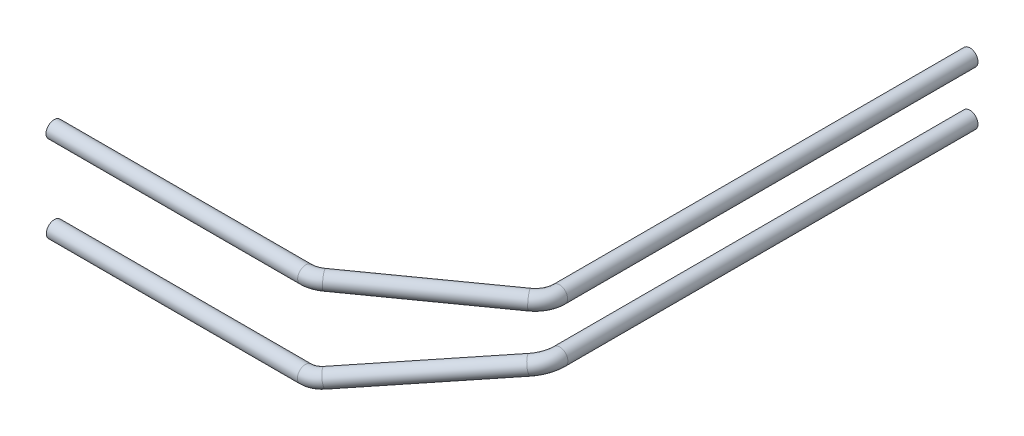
SolidWorks part; units mm, degrees
ref_plane "Front Plane" through (0, 0, 0) normal (0, 0, 1) x (1, 0, 0)
ref_plane "Top Plane" through (0, 0, 0) normal (0, 1, 0) x (1, 0, 0)
ref_plane "Right Plane" through (0, 0, 0) normal (1, 0, 0) x (0, 0, -1)
ref_plane "Drivers Side" through (635, 0, 0) normal (1, 0, 0) x (0, 0, -1)
ref_plane "Passengers Side" through (-635, 0, 0) normal (1, 0, 0) x (0, 0, -1)
ref_plane "Front" through (0, 0, 635) normal (0, 0, 1) x (1, 0, 0)
ref_plane "Top" through (0, 127, 0) normal (0, 1, 0) x (1, 0, 0)
sketch3d "3DSketch1"
  line L0 (635, 0, 376.4876) -> (635, 0, -588.4348)
  line L1 (-635, 0, 635) -> (-635, 0, -635) construction
  line L2 (-635, 0, 635) -> (635, 0, 635) construction
  line L3 (635, 0, 635) -> (635, 0, -635) construction
  line L4 (-635, 0, -635) -> (635, 0, -635) construction
  line L5 (-635, 0, 635) -> (635, 0, -635) construction
  line L6 (635, 0, 635) -> (-635, 0, -635) construction
  line L7 (-295.2601, -76.2, 635) -> (295.2601, -76.2, 635)
  line L8 (329.593, -72.5753, 624.126) -> (611.087, -5.6826, 423.4477)
  line L9 (0, 0, 0) -> (0, -76.2, 635) construction
  line L10 (-296.0068, 127, 635) -> (296.0542, 127, 635)
  line L11 (329.2293, 127, 624.3853) -> (611.0252, 127, 423.4918)
  line L12 (635, 127, 376.9565) -> (635, 127, -588.4348)
  arc A0 (635, 0, 376.4876) -> (611.087, -5.6826, 423.4477) centre (579.3984, -13.2129, 376.4876) ccw
  arc A1 (295.2601, -76.2, 635) -> (329.593, -72.5753, 624.126) centre (295.2601, -58.1276, 580.7827) ccw
  arc A2 (611.0252, 127, 423.4918) -> (635, 127, 376.9565) centre (577.85, 127, 376.9565) ccw
  arc A3 (296.0542, 127, 635) -> (329.2293, 127, 624.3853) centre (296.0542, 127, 577.85) ccw
  point P0 (0, 0, 0)
  point P15 (635, 0, 406.4)
  point P16 (592.6112, -68.8145, 376.4876)
  point P19 (314.3399, -76.2, 635)
  point P20 (295.2601, -3.9103, 598.8552)
  point P24 (0, 0, 0)
  point P25 (0, 0, 0)
  point P26 (-296.0068, 101.6, 635)
  point P29 (635, 127, 406.4)
  point P30 (577.85, 184.15, 376.9565)
  point P33 (314.3399, 127, 635)
  point P34 (296.0542, 184.15, 577.85)
  point P35 (635, 101.6, -566.9467)
  point P36 (635, 0, -588.4348)
  dimension "D4" = 57.15
  dimension "D5" = 57.15
  dimension "D1" = 609.6
  dimension "D2" = 76.2
  dimension "D3" = 228.6
other "Stainless round tube 1.50 X .065(1)"
ref_plane "Plane5" through (-296.0068, 127, 635) normal (1, 0, 0) x (0, 0, -1)
sketch "Profile" plane through (-296.0068, 127, 635) normal (1, 0, 0) x (0, 0, -1)
  circle A0 centre (0, 0) radius 19.05
  circle A1 centre (0, 0) radius 17.399
  point P4 (0, 0)
  dimension "D" = 38.1
  dimension "T" = 1.651
other "Stainless round tube 1.50 X .065(2)"
ref_plane "Plane6" through (-295.2601, -76.2, 635) normal (1, 0, 0) x (0, 0, -1)
sketch "Profile1" plane through (-295.2601, -76.2, 635) normal (1, 0, 0) x (0, 0, -1)
  circle A0 centre (0, 0) radius 19.05
  circle A1 centre (0, 0) radius 17.399
  point P4 (0, 0)
  dimension "D" = 38.1
  dimension "T" = 1.651
